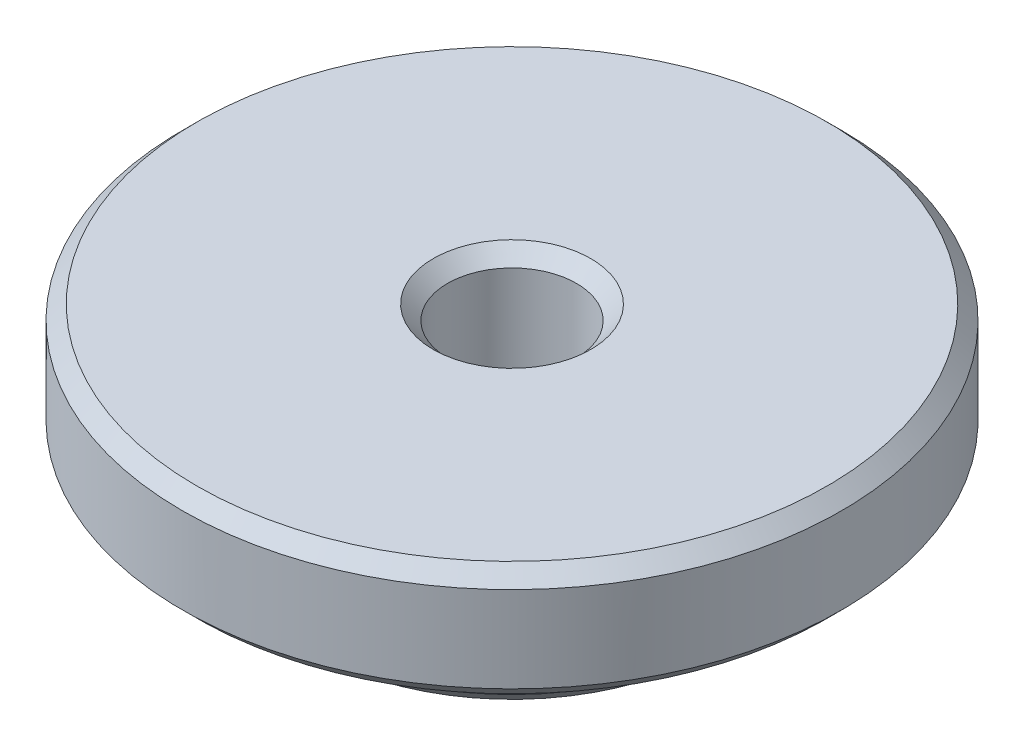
SolidWorks part; units mm, degrees
ref_plane "Plan de face" through (0, 0, 0) normal (0, 0, 1) x (1, 0, 0)
ref_plane "Plan de dessus" through (0, 0, 0) normal (0, 1, 0) x (1, 0, 0)
ref_plane "Plan de droite" through (0, 0, 0) normal (1, 0, 0) x (0, 0, -1)
sketch "Esquisse1" plane through (0, 0, 0) normal (0, 0, 1) x (1, 0, 0)
  line L0 (0, 0) -> (0, 75.4335) construction
  line L1 (0, 75.4335) -> (0, -79.259) construction
  line L2 (0, 0) -> (15, 0)
  line L3 (15, 0) -> (15, 6)
  line L4 (15, 6) -> (23, 6)
  line L5 (23, 6) -> (23, 14)
  line L6 (23, 14) -> (0, 14)
  line L7 (0, 14) -> (0, 0)
  dimension "D1" = 15
  dimension "D2" = 23
  dimension "D3" = 6
  dimension "D4" = 8
revolve "Révolution1" add sketch "Esquisse1" angle 360 about L0
sketch "Esquisse2" plane through (0, 14, 0) normal (0, 1, 0) x (1, 0, 0)
  circle A0 centre (0, 0) radius 4.5
  dimension "D1" = 9
extrude "Enlèv. mat.-Extru.1" cut sketch "Esquisse2" against normal through all
chamfer "Chanfrein1" distance 1 angle 45 5 edges at (0, 14, 4.5) (0, 14, -23) (0, 6, -23) (0, 0, -15) (0, 0, 4.5)
